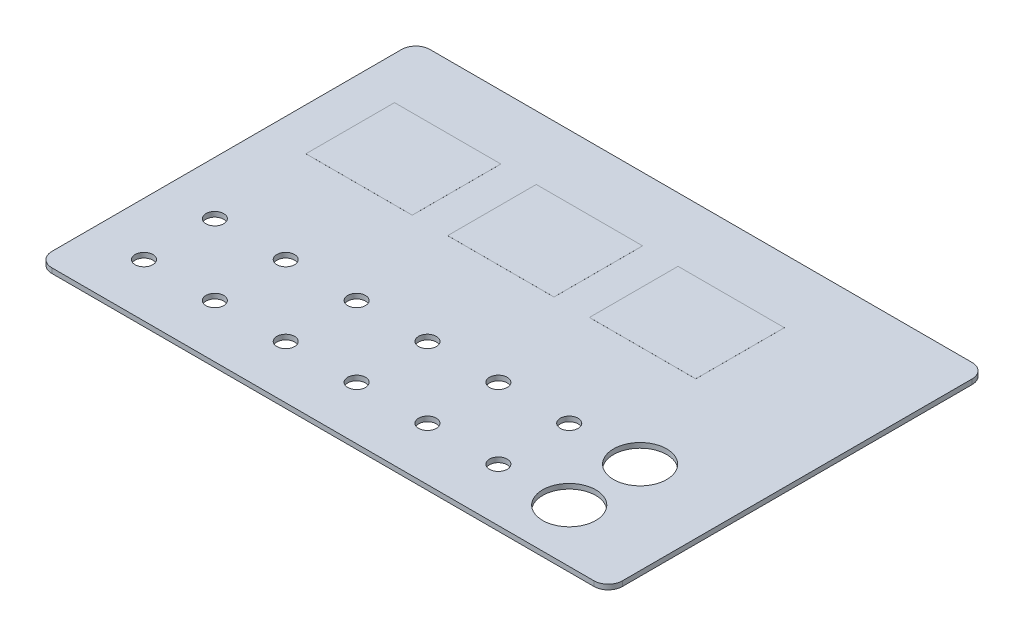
SolidWorks part; units mm, degrees
ref_plane "Front Plane" through (0, 0, 0) normal (0, 0, 1) x (1, 0, 0)
ref_plane "Top Plane" through (0, 0, 0) normal (0, 1, 0) x (1, 0, 0)
ref_plane "Right Plane" through (0, 0, 0) normal (1, 0, 0) x (0, 0, -1)
sketch "Sketch1" plane through (-75.6238, 0, 44.9723) normal (0, 1, 0) x (1, 0, 0)
  line L1 (0.9181, 107.4574) -> (161.9181, 107.4574)
  line L2 (0.9181, 107.4574) -> (0.9181, 0.7574)
  line L3 (0.9181, 0.7574) -> (161.9181, 0.7574)
  line L4 (161.9181, 107.4574) -> (161.9181, 0.7574)
  dimension "D1" = 161
  dimension "D2" = 106.7
extrude "Boss-Extrude1" add sketch "Sketch1" along normal blind 1.4
sketch "Sketch2" plane through (-75.6238, 1.4, 44.9723) normal (0, 1, 0) x (1, 0, 0)
  line L0 (0.9181, 107.4574) -> (0.9181, 0.7574) construction
  line L1 (0.9181, 0.7574) -> (161.9181, 0.7574) construction
  circle A0 centre (15.9181, 15.7574) radius 2.5
  circle A1 centre (15.9181, 35.7574) radius 2.5
  circle A2 centre (35.9181, 15.7574) radius 2.5
  circle A3 centre (35.9181, 35.7574) radius 2.5
  circle A4 centre (55.9181, 35.7574) radius 2.5
  circle A5 centre (55.9181, 15.7574) radius 2.5
  circle A6 centre (75.9181, 15.7574) radius 2.5
  circle A7 centre (75.9181, 35.7574) radius 2.5
  circle A8 centre (95.9181, 15.7574) radius 2.5
  circle A9 centre (95.9181, 35.7574) radius 2.5
  circle A10 centre (115.9181, 15.7574) radius 2.5
  circle A11 centre (115.9181, 35.7574) radius 2.5
  circle A12 centre (135.9181, 15.7574) radius 7.5
  circle A13 centre (135.9181, 35.7574) radius 7.5
  dimension "D1" = 5
  dimension "D29" = 15
  dimension "D30" = 15
  dimension "D2" = 15
  dimension "D3" = 15
  dimension "D4" = 20
  dimension "D5" = 20
  dimension "D6" = 15
  dimension "D7" = 15
  dimension "D8" = 20
  dimension "D9" = 20
  dimension "D10" = 15
  dimension "D11" = 15
  dimension "D12" = 20
  dimension "D13" = 20
  dimension "D14" = 15
  dimension "D15" = 20
  dimension "D16" = 20
  dimension "D17" = 20
  dimension "D18" = 20
  dimension "D19" = 20
  dimension "D20" = 15
  dimension "D21" = 15
  dimension "D22" = 20
  dimension "D23" = 20
  dimension "D24" = 20
  dimension "D25" = 20
  dimension "D26" = 20
  dimension "D27" = 20
  dimension "D28" = 20
  dimension "D31" = 20
extrude "Cut-Extrude1" cut sketch "Sketch2" against normal through all
sketch "Sketch3" plane through (-75.6238, 1.4, 44.9723) normal (0, 1, 0) x (1, 0, 0)
  line L0 (161.9181, 107.4574) -> (0.9181, 107.4574) construction
  line L1 (12.9181, 89.4574) -> (42.9181, 89.4574)
  line L2 (12.9181, 89.4574) -> (12.9181, 64.4574)
  line L3 (12.9181, 64.4574) -> (42.9181, 64.4574)
  line L4 (42.9181, 89.4574) -> (42.9181, 64.4574)
  line L5 (0.9181, 107.4574) -> (0.9181, 0.7574) construction
  line L6 (52.9181, 89.4574) -> (82.9181, 89.4574)
  line L7 (52.9181, 89.4574) -> (52.9181, 64.4574)
  line L8 (52.9181, 64.4574) -> (82.9181, 64.4574)
  line L9 (82.9181, 89.4574) -> (82.9181, 64.4574)
  line L10 (92.9181, 89.4574) -> (122.9181, 89.4574)
  line L11 (92.9181, 89.4574) -> (92.9181, 64.4574)
  line L12 (92.9181, 64.4574) -> (122.9181, 64.4574)
  line L13 (122.9181, 89.4574) -> (122.9181, 64.4574)
  dimension "D1" = 30
  dimension "D2" = 25
  dimension "D3" = 18
  dimension "D4" = 12
  dimension "D5" = 10
  dimension "D6" = 18
  dimension "D7" = 30
  dimension "D8" = 25
  dimension "D9" = 10
  dimension "D10" = 18
  dimension "D11" = 30
  dimension "D12" = 25
extrude "Boss-Extrude2" add sketch "Sketch3" along normal blind 0.01
fillet "Fillet1" radius 4 4 edges at (-74.7057, 0.7, -62.4851) (-74.7057, 0.7, 44.2149) (86.2943, 0.7, -62.4851) (86.2943, 0.7, 44.2149)
